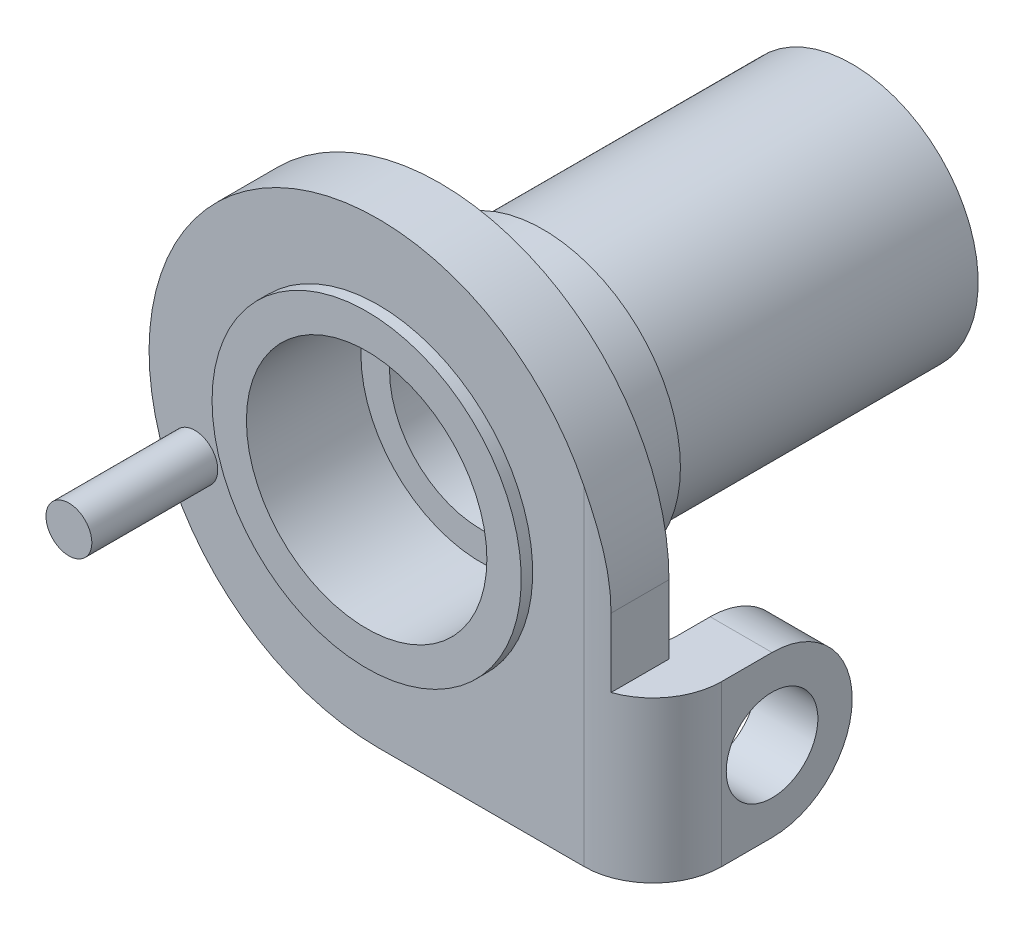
SolidWorks part; units mm, degrees
ref_plane "Plan1" through (0, 0, 0) normal (0, 0, 1) x (1, 0, 0)
ref_plane "Plan2" through (0, 0, 0) normal (0, 1, 0) x (1, 0, 0)
ref_plane "Plan3" through (0, 0, 0) normal (1, 0, 0) x (0, 0, -1)
mirrored part "support-réglage ressort-D-"
